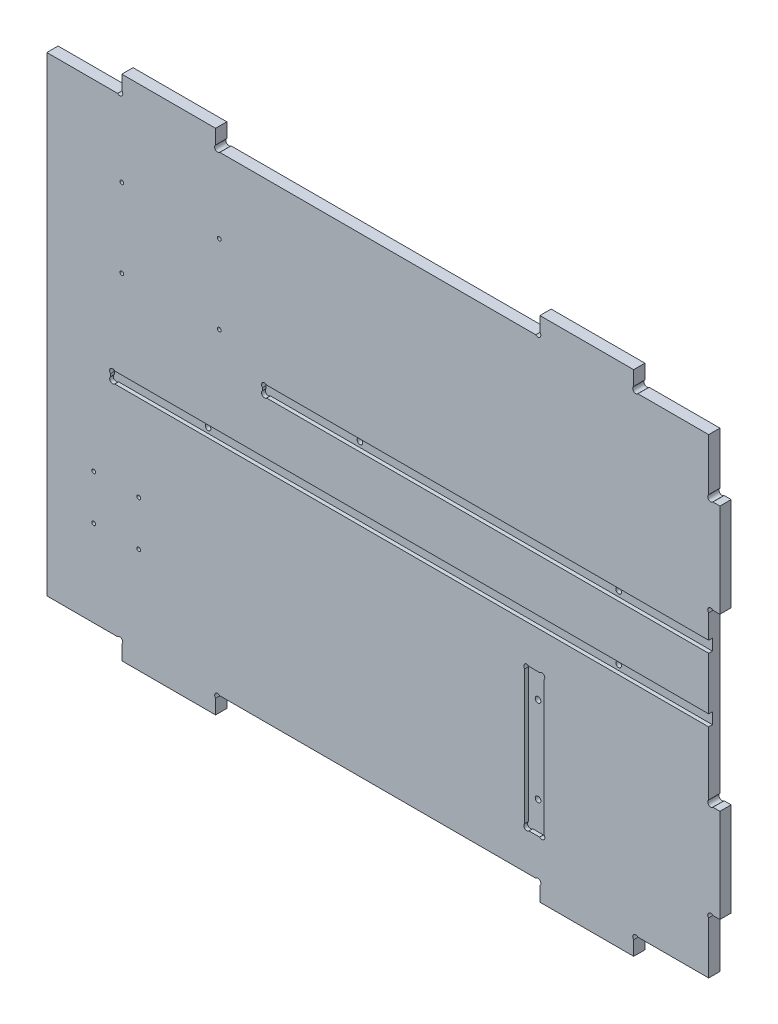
SolidWorks part; units mm, degrees
ref_plane "Face" through (0, 0, 0) normal (0, 0, 1) x (1, 0, 0)
ref_plane "Dessus" through (0, 0, 0) normal (0, 1, 0) x (1, 0, 0)
ref_plane "Droite" through (0, 0, 0) normal (1, 0, 0) x (0, 0, -1)
sketch "Esquisse1" plane through (0, 0, 0) normal (0, 0, 1) x (1, 0, 0)
  line L1 (-17.867, 38.1256) -> (335.133, 38.1256)
  line L2 (-17.867, 38.1256) -> (-17.867, -212.8744)
  line L3 (-17.867, -212.8744) -> (335.133, -212.8744)
  line L4 (335.133, 38.1256) -> (335.133, -212.8744)
  dimension "D1" = 353
  dimension "D2" = 251
extrude "Base-Extrusion" add sketch "Esquisse1" along normal blind 6
sketch "Esquisse2" plane through (0, 0, 6) normal (0, 0, 1) x (1, 0, 0)
  line L1 (335.133, -212.8744) -> (335.133, 38.1256) construction
  line L2 (247.233, -116.8744) -> (237.033, -116.8744)
  line L3 (247.233, -116.8744) -> (247.233, -192.8744)
  line L4 (247.233, -192.8744) -> (237.033, -192.8744)
  line L5 (237.033, -116.8744) -> (237.033, -192.8744)
  line L6 (335.133, 38.1256) -> (-17.867, 38.1256) construction
  dimension "D1" = 87.9
  dimension "D2" = 10.2
  dimension "D3" = 76
  dimension "D4" = 155
extrude "Enlèv. mat.-Extru.1" cut sketch "Esquisse2" against normal blind 2
sketch "Esquisse4" plane through (0, 0, 6) normal (0, 0, 1) x (1, 0, 0)
  line L1 (335.133, -212.8744) -> (335.133, 38.1256) construction
  line L2 (335.133, -56.8744) -> (97.133, -56.8744)
  line L3 (335.133, -56.8744) -> (335.133, -62.8744)
  line L4 (335.133, -62.8744) -> (97.133, -62.8744)
  line L6 (97.133, -56.8744) -> (97.133, -62.8744)
  line L7 (335.133, 38.1256) -> (-17.867, 38.1256) construction
  line L8 (335.133, -90.8744) -> (16.133, -90.8744)
  line L10 (335.133, -90.8744) -> (335.133, -96.8744)
  line L11 (335.133, -96.8744) -> (16.133, -96.8744)
  line L12 (16.133, -90.8744) -> (16.133, -96.8744)
  dimension "D1" = 6
  dimension "D2" = 6
  dimension "D3" = 238
  dimension "D4" = 40
  dimension "D5" = 95
  dimension "D6" = 319
extrude "Enlèv. mat.-Extru.3" cut sketch "Esquisse4" against normal blind 2
sketch "Esquisse8" plane through (0, 0, 6) normal (0, 0, 1) x (1, 0, 0)
  line L1 (-17.867, 38.1256) -> (-17.867, -212.8744) construction
  line L2 (335.133, 38.1256) -> (-17.867, 38.1256) construction
  circle A0 centre (7.133, -166.8744) radius 1
  circle A1 centre (7.133, -142.8744) radius 1
  circle A2 centre (31.133, -166.8744) radius 1
  circle A3 centre (31.133, -142.8744) radius 1
  dimension "D1" = 2
  dimension "D6" = 2
  dimension "D9" = 2
  dimension "D10" = 2
  dimension "D4" = 24
  dimension "D5" = 25
  dimension "D8" = 24
  dimension "D11" = 24
  dimension "D12" = 24
  dimension "D13" = 181
extrude "Enlèv. mat.-Extru.7" cut sketch "Esquisse8" against normal up to vertex
sketch "Esquisse3" plane through (0, 0, 4) normal (0, 0, 1) x (1, 0, 0)
  line L1 (247.233, -116.8744) -> (237.033, -116.8744) construction
  line L4 (237.033, -192.8744) -> (247.233, -192.8744) construction
  line L5 (237.033, -116.8744) -> (237.033, -192.8744) construction
  line L7 (335.133, -56.8744) -> (335.133, 38.1256) construction
  line L8 (97.133, -56.8744) -> (97.133, -62.8744) construction
  line L9 (335.133, -56.8744) -> (97.133, -56.8744) construction
  line L10 (335.133, -90.8744) -> (16.133, -90.8744) construction
  line L11 (335.133, -90.8744) -> (335.133, -62.8744) construction
  line L12 (16.133, -90.8744) -> (16.133, -96.8744) construction
  circle A0 centre (242.133, -177.8744) radius 1.5
  circle A1 centre (285.133, -59.9744) radius 1.5
  circle A2 centre (242.133, -131.8744) radius 1.5
  circle A3 centre (147.133, -59.9744) radius 1.5
  circle A4 centre (285.133, -93.9744) radius 1.5
  circle A5 centre (66.133, -93.9744) radius 1.5
  point P2 (242.133, -116.8744)
  dimension "D1" = 3
  dimension "D2" = 15
  dimension "D3" = 3
  dimension "D7" = 50
  dimension "D11" = 3.1
  dimension "D4" = 15
  dimension "D5" = 5.1
  dimension "D6" = 5.1
  dimension "D8" = 50
  dimension "D9" = 3.1
  dimension "D10" = 3.1
  dimension "D12" = 50
  dimension "D13" = 50
  dimension "D14" = 3.1
extrude "Enlèv. mat.-Extru.2" cut sketch "Esquisse3" against normal up to vertex (4 mm away)
sketch "Esquisse9" plane through (0, 0, 6) normal (0, 0, 1) x (1, 0, 0)
  line L3 (237.033, -116.8744) -> (237.033, -192.8744) construction
  line L4 (247.233, -116.8744) -> (237.033, -116.8744) construction
  line L5 (247.233, -192.8744) -> (247.233, -116.8744) construction
  line L6 (237.033, -192.8744) -> (247.233, -192.8744) construction
  line L7 (97.133, -56.8744) -> (97.133, -62.8744) construction
  line L8 (335.133, -56.8744) -> (97.133, -56.8744) construction
  line L9 (97.133, -62.8744) -> (335.133, -62.8744) construction
  line L10 (16.133, -90.8744) -> (16.133, -96.8744) construction
  line L11 (335.133, -90.8744) -> (16.133, -90.8744) construction
  line L12 (16.133, -96.8744) -> (335.133, -96.8744) construction
  circle A0 centre (246.133, -117.9744) radius 1.6
  circle A1 centre (238.133, -117.9744) radius 1.6
  circle A2 centre (246.133, -191.7744) radius 1.6
  circle A3 centre (238.133, -191.7744) radius 1.6
  circle A4 centre (98.233, -57.9744) radius 1.6
  circle A5 centre (98.233, -61.7744) radius 1.6
  circle A6 centre (17.233, -91.9744) radius 1.6
  circle A7 centre (17.233, -95.7744) radius 1.6
  dimension "D1" = 1.1
  dimension "D3" = 1.1
  dimension "D5" = 1.1
  dimension "D7" = 1.1
  dimension "D9" = 1.1
  dimension "D13" = 1.1
  dimension "D2" = 1.1
  dimension "D4" = 1.1
  dimension "D6" = 1.1
  dimension "D8" = 1.1
  dimension "D10" = 1.1
  dimension "D11" = 1.1
  dimension "D12" = 1.1
  dimension "D14" = 1.1
  dimension "D15" = 1.1
  dimension "D16" = 1.1
extrude "Enlèv. mat.-Extru.8" cut sketch "Esquisse9" against normal blind 2
sketch "Esquisse10" plane through (335.133, 0, 0) normal (1, 0, 0) x (0, 0, -1)
  line L0 (-6, -56.8744) -> (-6, 38.1256) construction
  line L1 (-6, 8.1256) -> (0, 8.1256)
  line L2 (-6, 8.1256) -> (-6, -41.8744)
  line L3 (-6, -41.8744) -> (0, -41.8744)
  line L4 (0, 8.1256) -> (0, -41.8744)
  line L5 (0, -212.8744) -> (0, 38.1256) construction
  line L6 (-6, 38.1256) -> (0, 38.1256) construction
  line L7 (-6, -212.8744) -> (-6, -96.8744) construction
  line L8 (-6, -182.8744) -> (0, -182.8744)
  line L9 (-6, -182.8744) -> (-6, -132.8744)
  line L10 (-6, -132.8744) -> (0, -132.8744)
  line L11 (0, -182.8744) -> (0, -132.8744)
  line L12 (-6, -212.8744) -> (0, -212.8744) construction
  dimension "D1" = 30
  dimension "D2" = 50
  dimension "D3" = 50
  dimension "D4" = 30
extrude "Extrusion1" add sketch "Esquisse10" along normal blind 6
sketch "Esquisse13" plane through (0, -212.8744, 0) normal (0, -1, 0) x (1, 0, 0)
  line L0 (-17.867, 6) -> (335.133, 6) construction
  line L1 (22.133, 6) -> (72.133, 6)
  line L2 (22.133, 6) -> (22.133, 0)
  line L3 (22.133, 0) -> (72.133, 0)
  line L4 (72.133, 6) -> (72.133, 0)
  line L5 (-17.867, 0) -> (335.133, 0) construction
  line L6 (-17.867, 6) -> (-17.867, 0) construction
  line L7 (335.133, 6) -> (335.133, 0) construction
  line L8 (295.133, 6) -> (245.133, 6)
  line L9 (295.133, 6) -> (295.133, 0)
  line L10 (295.133, 0) -> (245.133, 0)
  line L11 (245.133, 6) -> (245.133, 0)
  dimension "D1" = 50
  dimension "D2" = 40
  dimension "D3" = 50
  dimension "D4" = 40
extrude "Extrusion2" add sketch "Esquisse13" along normal blind 10
sketch "Esquisse15" plane through (0, 38.1256, 0) normal (0, 1, 0) x (-1, 0, 0)
  line L0 (-335.133, 6) -> (17.867, 6) construction
  line L1 (-295.133, 6) -> (-245.133, 6)
  line L2 (-295.133, 6) -> (-295.133, 0)
  line L3 (-295.133, 0) -> (-245.133, 0)
  line L4 (-245.133, 6) -> (-245.133, 0)
  line L5 (-335.133, 0) -> (17.867, 0) construction
  line L6 (-335.133, 6) -> (-335.133, 0) construction
  line L7 (17.867, 6) -> (17.867, 0) construction
  line L8 (-22.133, 6) -> (-72.133, 6)
  line L9 (-22.133, 6) -> (-22.133, 0)
  line L10 (-22.133, 0) -> (-72.133, 0)
  line L11 (-72.133, 6) -> (-72.133, 0)
  point P14 (17.867, 3)
  dimension "D1" = 50
  dimension "D2" = 40
  dimension "D3" = 50
  dimension "D4" = 40
extrude "Extrusion3" add sketch "Esquisse15" along normal blind 10
sketch "Esquisse11" plane through (0, 0, 6) normal (0, 0, 1) x (1, 0, 0)
  line L0 (335.133, 8.1256) -> (335.133, 38.1256) construction
  line L1 (341.133, 8.1256) -> (335.133, 8.1256) construction
  line L2 (335.133, -56.8744) -> (335.133, -41.8744) construction
  line L3 (341.133, -41.8744) -> (335.133, -41.8744) construction
  line L4 (335.133, -132.8744) -> (335.133, -96.8744) construction
  line L5 (341.133, -132.8744) -> (335.133, -132.8744) construction
  line L6 (341.133, -182.8744) -> (335.133, -182.8744) construction
  line L7 (335.133, -212.8744) -> (335.133, -182.8744) construction
  line L8 (72.133, -212.8744) -> (245.133, -212.8744) construction
  line L9 (72.133, -222.8744) -> (72.133, -212.8744) construction
  line L10 (-17.867, -212.8744) -> (22.133, -212.8744) construction
  line L11 (22.133, -222.8744) -> (22.133, -212.8744) construction
  line L12 (295.133, -212.8744) -> (335.133, -212.8744) construction
  line L13 (245.133, -222.8744) -> (245.133, -212.8744) construction
  line L14 (295.133, -222.8744) -> (295.133, -212.8744) construction
  line L15 (335.133, 38.1256) -> (295.133, 38.1256) construction
  line L16 (295.133, 48.1256) -> (295.133, 38.1256) construction
  line L17 (245.133, 48.1256) -> (245.133, 38.1256) construction
  line L18 (245.133, 38.1256) -> (72.133, 38.1256) construction
  line L19 (22.133, 38.1256) -> (-17.867, 38.1256) construction
  line L20 (22.133, 48.1256) -> (22.133, 38.1256) construction
  line L21 (72.133, 48.1256) -> (72.133, 38.1256) construction
  circle A0 centre (336.233, 9.2256) radius 1.6
  circle A1 centre (336.233, -42.9744) radius 1.6
  circle A2 centre (336.233, -131.7744) radius 1.6
  circle A3 centre (336.233, -183.9744) radius 1.6
  circle A4 centre (21.033, -213.9744) radius 1.6
  circle A5 centre (73.233, -213.9744) radius 1.6
  circle A6 centre (296.233, -213.9744) radius 1.6
  circle A7 centre (244.033, -213.9744) radius 1.6
  circle A8 centre (244.033, 39.2256) radius 1.6
  circle A9 centre (296.233, 39.2256) radius 1.6
  circle A10 centre (21.033, 39.2256) radius 1.6
  circle A11 centre (73.233, 39.2256) radius 1.6
  point P54 (245.133, 43.1256)
  dimension "D5" = 1.1
  dimension "D9" = 1.1
  dimension "D13" = 1.1
  dimension "D17" = 1.1
  dimension "D21" = 1.1
  dimension "D1" = 1.1
  dimension "D2" = 1.1
  dimension "D3" = 1.1
  dimension "D4" = 1.1
  dimension "D6" = 1.1
  dimension "D7" = 1.1
  dimension "D8" = 1.1
  dimension "D10" = 1.1
  dimension "D11" = 1.1
  dimension "D12" = 1.1
  dimension "D14" = 1.1
  dimension "D15" = 1.1
  dimension "D16" = 1.1
  dimension "D18" = 1.1
  dimension "D19" = 1.1
  dimension "D20" = 1.1
  dimension "D22" = 1.1
  dimension "D23" = 1.1
  dimension "D24" = 1.1
extrude "Enlèv. mat.-Extru.9" cut sketch "Esquisse11" against normal up to vertex
sketch "Esquisse16" plane through (0, 0, 6) normal (0, 0, 1) x (1, 0, 0)
  line L0 (19.8711, 38.1256) -> (-17.867, 38.1256) construction
  line L1 (242.8711, 38.1256) -> (74.3949, 38.1256) construction
  line L2 (-17.867, 38.1256) -> (-17.867, -212.8744) construction
  circle A0 centre (22.133, -43.8744) radius 1
  circle A1 centre (22.133, -1.8744) radius 1
  circle A2 centre (74.133, -1.8744) radius 1
  circle A3 centre (74.133, -43.8744) radius 1
  dimension "D1" = 52
  dimension "D2" = 52
  dimension "D3" = 42
  dimension "D4" = 42
  dimension "D5" = 40
  dimension "D6" = 40
  dimension "D7" = 40
  dimension "D8" = 40
extrude "Enlèv. mat.-Extru.10" cut sketch "Esquisse16" against normal up to vertex
